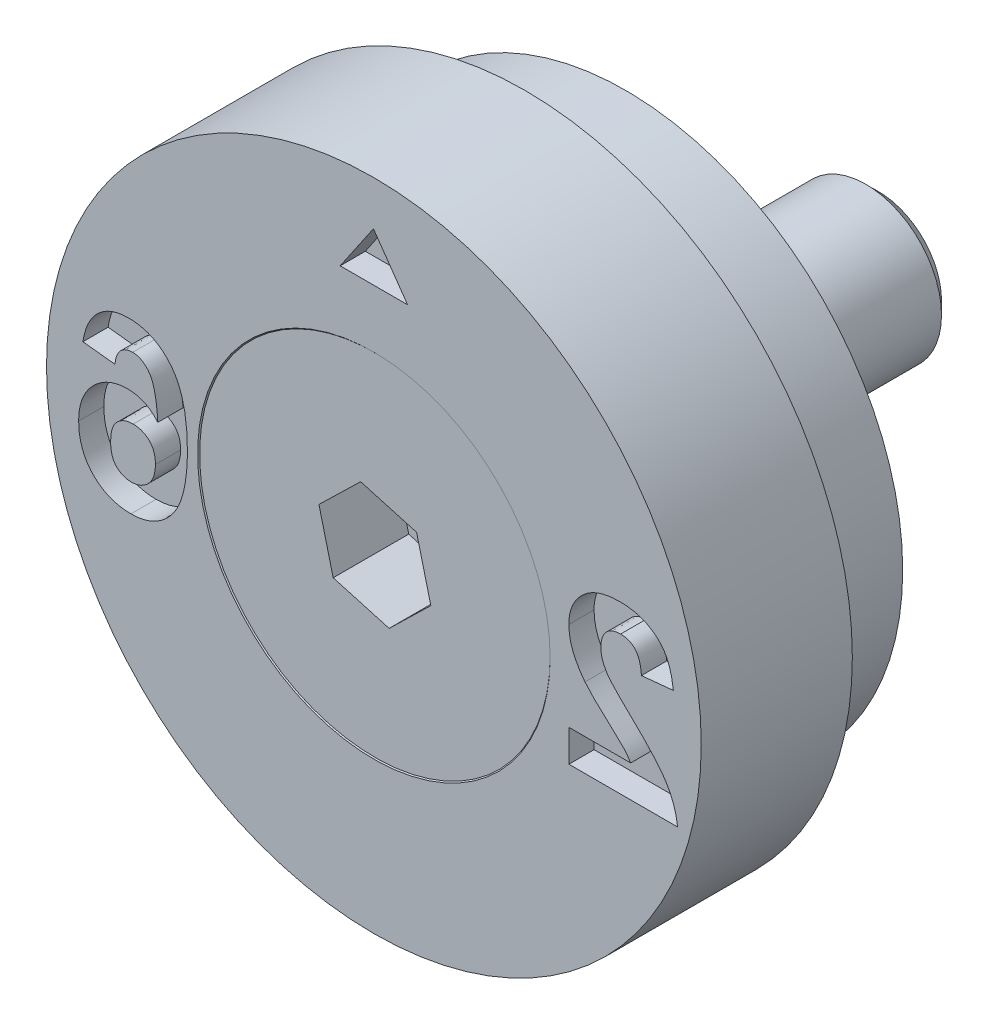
SolidWorks part; units mm, degrees
other "<M3 X .5 FHCS>-<Imported1>"
ref_plane "Front Plane" through (0, 0, 0) normal (0, 0, 1) x (1, 0, 0)
ref_plane "Top Plane" through (0, 0, 0) normal (0, 1, 0) x (1, 0, 0)
ref_plane "Right Plane" through (0, 0, 0) normal (1, 0, 0) x (0, 0, -1)
imported_body "Imported1"
sketch "Sketch1" plane through (0, 0, 0) normal (0, 0, 1) x (1, 0, 0)
  text T0 "2      6" font "Arial" height 3.302
  dimension "D1" = 1.651
  dimension "D2" = 6.2
extrude "Cut-Extrude1" cut sketch "Sketch1" against normal blind 0.5
inserted part "M3 X .5 FHCS"
move or copy body "Body-Move/Copy2" placed by mates yes
